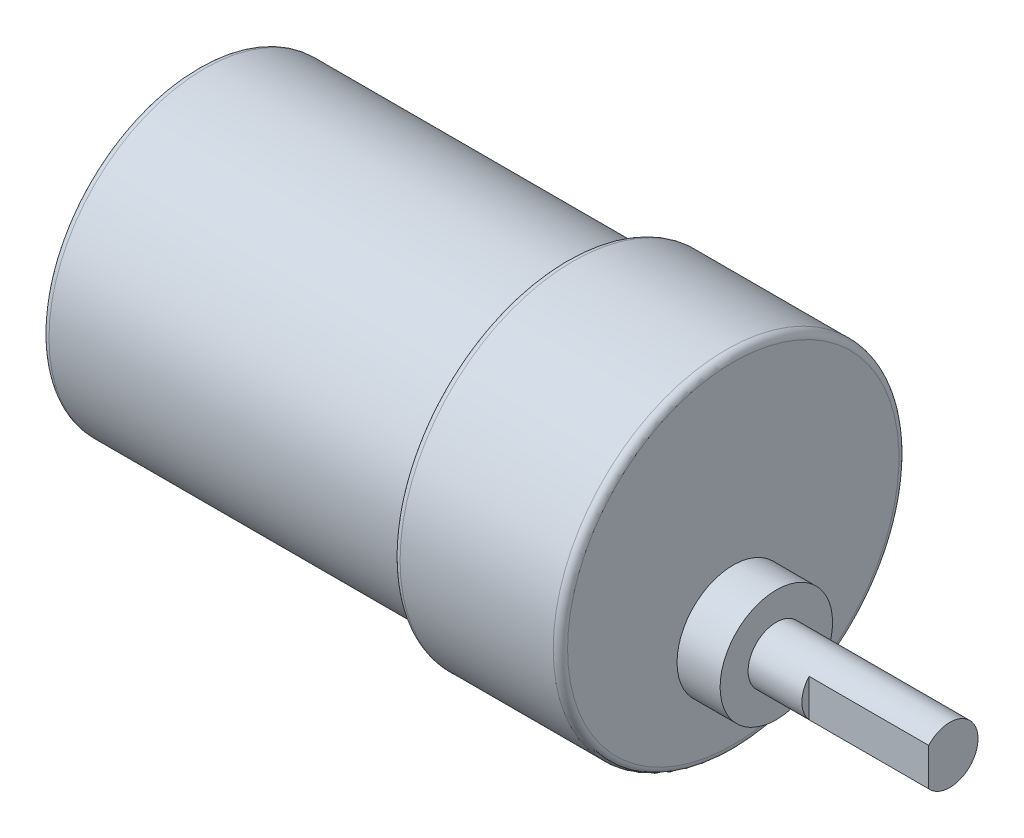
SolidWorks part; units mm, degrees
ref_plane "Front Plane" through (0, 0, 0) normal (0, 0, 1) x (1, 0, 0)
ref_plane "Top Plane" through (0, 0, 0) normal (0, 1, 0) x (1, 0, 0)
ref_plane "Right Plane" through (0, 0, 0) normal (1, 0, 0) x (0, 0, -1)
sketch "Sketch1" plane through (0, 0, 0) normal (0, 0, 1) x (1, 0, 0)
  line L0 (0, 3.175) -> (0, 16.51)
  line L1 (0, 16.51) -> (39.116, 16.51)
  line L2 (39.116, 18.3515) -> (56.896, 18.3515)
  line L3 (56.896, 18.3515) -> (56.896, 0)
  line L4 (39.116, 16.51) -> (39.116, 18.3515)
  line L5 (-2.286, 0) -> (56.896, 0) construction
  line L6 (0, 3.175) -> (-2.286, 3.175)
  line L7 (-2.286, 3.175) -> (-2.286, 0)
  line L8 (56.896, 0) -> (-2.286, 0)
  dimension "D1" = 16.51
  dimension "D2" = 39.116
  dimension "D3" = 17.78
  dimension "D4" = 18.3515
  dimension "D5" = 2.286
  dimension "D6" = 3.175
revolve "Revolve1" add sketch "Sketch1" angle 360 about L5
sketch "Sketch2" plane through (56.896, 0, 0) normal (1, 0, 0) x (0, 0, -1)
  line L0 (0, 0) -> (0, -7.0358) construction
  circle A0 centre (0, -7.0358) radius 5.969
  dimension "D2" = 11.938
  dimension "D1" = 7.0358
extrude "Boss-Extrude1" add sketch "Sketch2" along normal blind 4.572
sketch "Sketch3" plane through (61.468, 0, 0) normal (1, 0, 0) x (0, 0, -1)
  circle A0 centre (0, -7.0358) radius 3
  dimension "D1" = 6
extrude "Boss-Extrude2" add sketch "Sketch3" along normal blind 18.415
fillet "Fillet1" radius 0.762 4 edges at (56.896, 0, 18.3515) (39.116, 0, 18.3515) (0, 0, 16.51) (-2.286, 0, 3.175)
sketch "Sketch4" plane through (0, 0, 0) normal (0, 1, 0) x (1, 0, 0)
  line L1 (79.883, -3) -> (67.183, -3)
  line L2 (79.883, -3) -> (79.883, -2.238)
  line L3 (79.883, -2.238) -> (67.183, -2.238)
  line L4 (67.183, -3) -> (67.183, -2.238)
  dimension "D1" = 0.762
  dimension "D2" = 12.7
extrude "Cut-Extrude1" cut sketch "Sketch4" against normal through all
